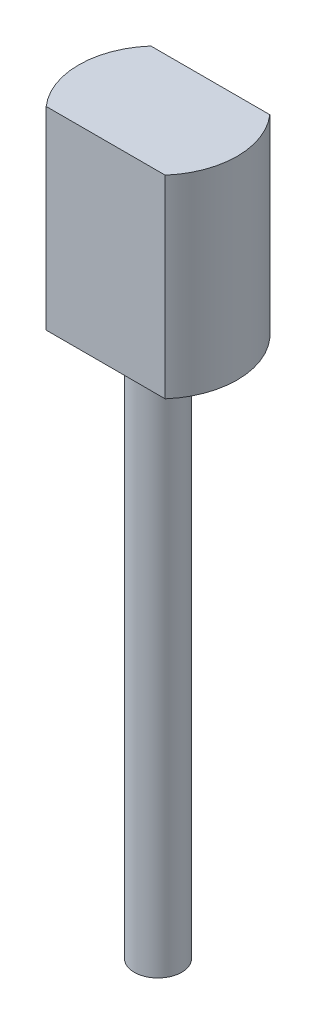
SolidWorks part; units mm, degrees
ref_plane "Front Plane" through (0, 0, 0) normal (0, 0, 1) x (1, 0, 0)
ref_plane "Top Plane" through (0, 0, 0) normal (0, 1, 0) x (1, 0, 0)
ref_plane "Right Plane" through (0, 0, 0) normal (1, 0, 0) x (0, 0, -1)
sketch "Sketch1" plane through (0, 0, 0) normal (0, 1, 0) x (1, 0, 0)
  circle A0 centre (0, 0) radius 3.4798
  dimension "D1" = 6.9596
extrude "Boss-Extrude1" add sketch "Sketch1" along normal blind 8.509
sketch "Sketch2" plane through (0, 0, 0) normal (0, -1, 0) x (1, 0, 0)
  circle A0 centre (0, 0) radius 1.0414
  dimension "D1" = 2.0828
extrude "Boss-Extrude2" add sketch "Sketch2" along normal blind 23.749
sketch "Sketch3" plane through (0, 8.509, 0) normal (0, 1, 0) x (1, 0, 0)
  line L0 (-2.6125, 2.2987) -> (2.6125, 2.2987)
  line L1 (-2.6125, -2.2987) -> (2.6125, -2.2987)
  line L2 (-3.4798, 0) -> (3.4798, 0) construction
  circle A0 centre (0, 0) radius 3.4798 construction
  arc A1 (2.6125, -2.2987) -> (2.6125, 2.2987) centre (0, 0) ccw
  arc A2 (-2.6125, 2.2987) -> (-2.6125, -2.2987) centre (0, 0) ccw
  dimension "D1" = 4.5974
extrude "Cut-Extrude1" cut sketch "Sketch3" against normal up to surface (8.509 mm away) flip side to cut
